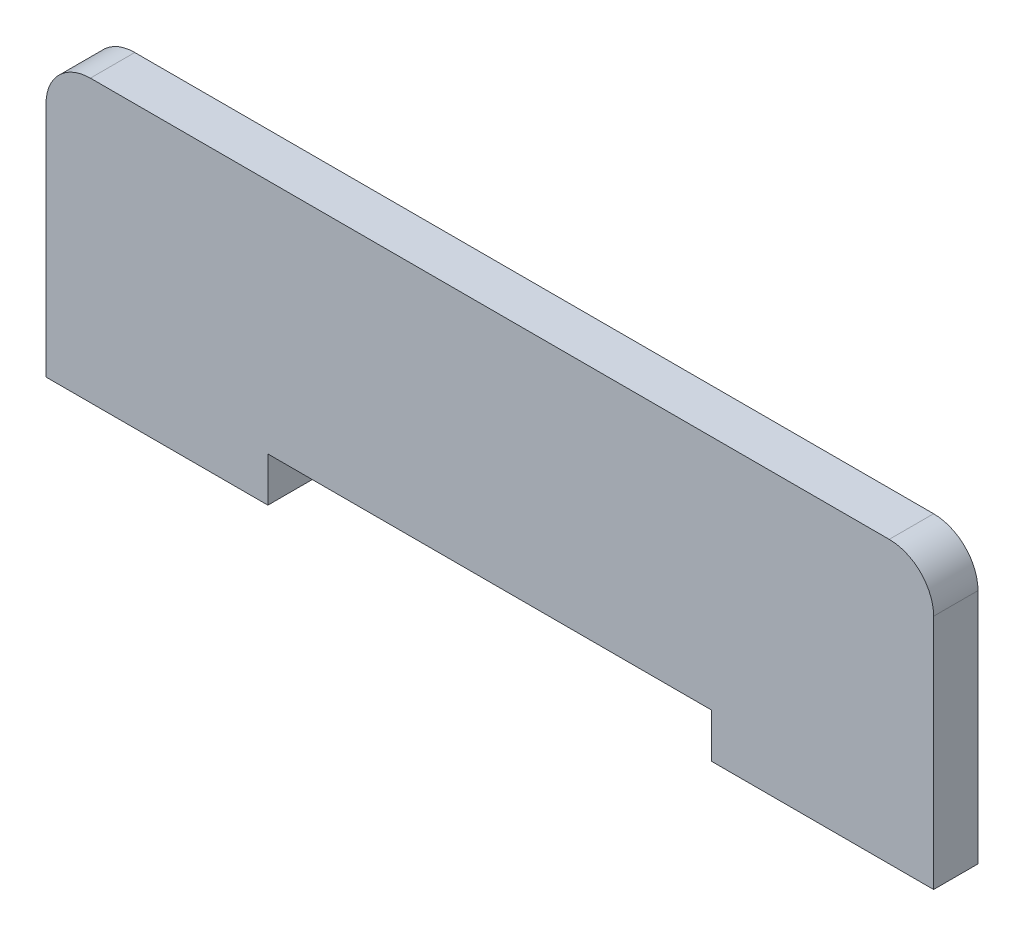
SolidWorks part; units mm, degrees
ref_plane "Front Plane" through (0, 0, 0) normal (0, 0, 1) x (1, 0, 0)
ref_plane "Top Plane" through (0, 0, 0) normal (0, 1, 0) x (1, 0, 0)
ref_plane "Right Plane" through (0, 0, 0) normal (1, 0, 0) x (0, 0, -1)
sketch "Sketch1" plane through (0, 0, 0) normal (0, 0, 1) x (1, 0, 0)
  line L0 (0, 0) -> (15, 0)
  line L1 (15, 0) -> (15, 3)
  line L2 (15, 3) -> (45, 3)
  line L3 (45, 3) -> (45, 0)
  line L4 (45, 0) -> (60, 0)
  line L5 (60, 0) -> (60, 3)
  line L6 (60, 3) -> (60, 19)
  line L7 (60, 19) -> (0, 19)
  line L8 (0, 19) -> (0, 3)
  line L9 (0, 3) -> (0, 0)
  dimension "D1" = 16
  dimension "D2" = 3
  dimension "D3" = 3
  dimension "D4" = 16
  dimension "D5" = 3
  dimension "D6" = 30
  dimension "D7" = 15
  dimension "D8" = 15
extrude "Boss-Extrude1" add sketch "Sketch1" along normal blind 3
fillet "Fillet1" radius 3 2 edges at (60, 19, 1.5) (0, 19, 1.5)
